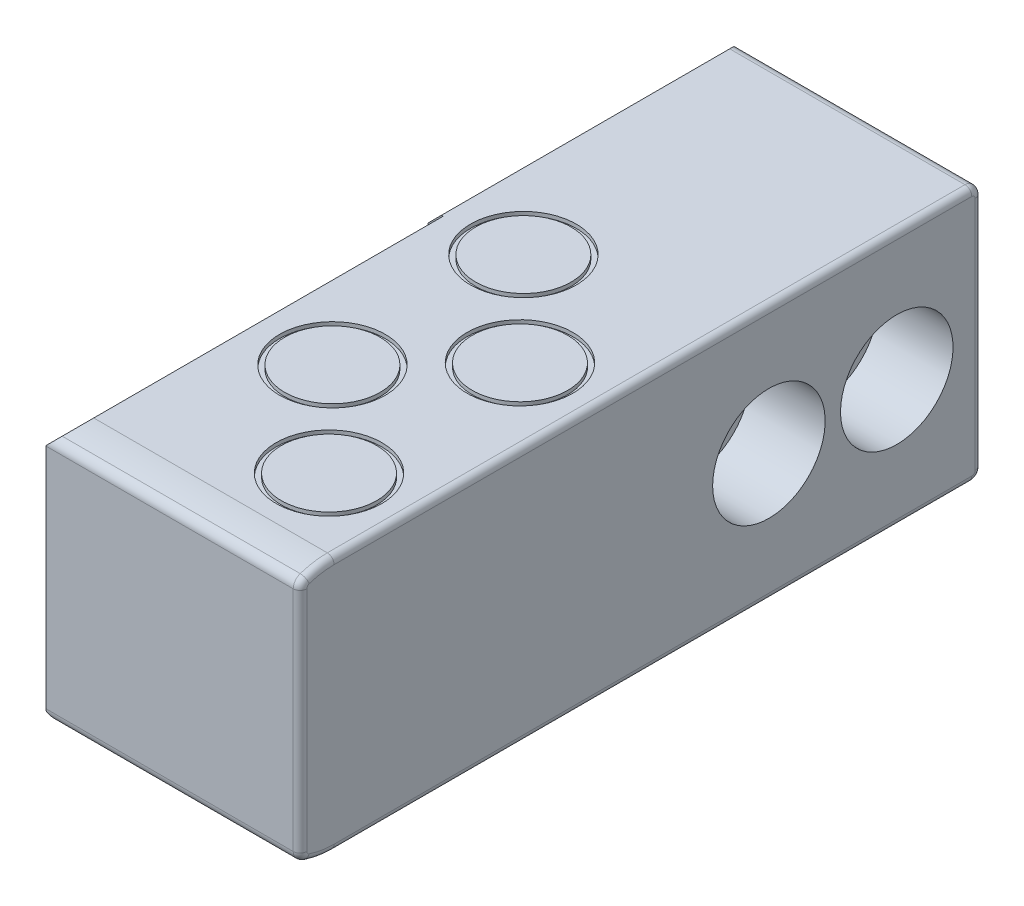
SolidWorks part; units mm, degrees
ref_plane "Front Plane" through (0, 0, 0) normal (0, 0, 1) x (1, 0, 0)
ref_plane "Top Plane" through (0, 0, 0) normal (0, 1, 0) x (1, 0, 0)
ref_plane "Right Plane" through (0, 0, 0) normal (1, 0, 0) x (0, 0, -1)
sketch "Sketch1" plane through (0, 0, 0) normal (1, 0, 0) x (0, 0, -1)
  line L0 (0, 0) -> (-28.575, 0) construction
  line L1 (-26.035, -9.525) -> (21.463, -9.525)
  line L2 (-28.575, -8.4726) -> (-28.575, 8.4726)
  line L3 (-26.035, 9.525) -> (21.463, 9.525)
  line L4 (22.225, -8.763) -> (22.225, 8.763)
  line L5 (0, 0) -> (22.225, 0) construction
  arc A0 (21.463, -9.525) -> (22.225, -8.763) centre (21.463, -8.763) ccw
  arc A1 (21.463, 9.525) -> (22.225, 8.763) centre (21.463, 8.763) cw
  arc A2 (-26.035, 9.525) -> (-28.0555, 9.195) centre (-26.035, 3.175) ccw
  arc A3 (-26.035, -9.525) -> (-28.0555, -9.195) centre (-26.035, -3.175) cw
  arc A4 (-28.575, -8.4726) -> (-28.0555, -9.195) centre (-27.813, -8.4726) ccw
  arc A5 (-28.0555, 9.195) -> (-28.575, 8.4726) centre (-27.813, 8.4726) ccw
  circle A6 centre (15.875, 0) radius 2.794
  circle A7 centre (6.35, 0) radius 2.794
  point P17 (-28.575, -8.9949)
  point P20 (-28.575, 8.9949)
  dimension "D5" = 0.762
  dimension "D9" = 6.35
  dimension "D4" = 0.762
  dimension "D7" = 5.588
  dimension "D10" = 5.588
  dimension "D2" = 50.8
  dimension "D3" = 22.225
  dimension "D6" = 2.54
  dimension "D8" = 6.35
  dimension "D11" = 9.525
  dimension "D12" = 19.05
  dimension "D13" = 0.33
extrude "Boss-Extrude1" add sketch "Sketch1" against normal blind 19.05
sketch "Sketch2" plane through (0, 9.525, 0) normal (0, 1, 0) x (1, 0, 0)
  line L0 (-19.05, 21.463) -> (-19.05, -26.035) construction
  line L1 (0, 21.463) -> (0, -26.035) construction
  line L5 (-19.05, -26.035) -> (0, -26.035) construction
  circle A2 centre (-12.446, -13.716) radius 3.937
  circle A3 centre (-12.446, -13.716) radius 3.556
  circle A4 centre (-5.588, -20.828) radius 3.556
  circle A5 centre (-5.588, -20.828) radius 3.937
  dimension "D1" = 1.27
  dimension "D2" = 5.588
  dimension "D5" = 7.874
  dimension "D7" = 6.604
  dimension "D8" = 7.112
  dimension "D3" = 7.112
  dimension "D4" = 6.858
  dimension "D9" = 12.446
extrude "Cut-Extrude1" cut sketch "Sketch2" against normal blind 0.2794
pattern_linear "LPattern2" count 2 spacing 14.224 along (0, 0, -1) of "Cut-Extrude1"
sketch "Sketch6" plane through (0, -9.525, 0) normal (0, -1, 0) x (1, 0, 0)
  line L0 (0, 61.1937) -> (0, -11.59) construction
  line L1 (-30.7169, 0) -> (6.3643, 0) construction
  circle A0 centre (-4.572, 45.72) radius 3.556
  circle A1 centre (-4.572, 45.72) radius 3.175
  circle A2 centre (-13.716, 45.72) radius 3.556
  circle A3 centre (-13.716, 45.72) radius 3.175
  circle A4 centre (-9.144, 39.116) radius 3.556
  circle A5 centre (-9.144, 39.116) radius 3.175
  dimension "D1" = 0.381
  dimension "D2" = 6.35
  dimension "D8" = 1.016
  dimension "D3" = 4.572
  dimension "D4" = 9.144
  dimension "D5" = 4.572
  dimension "D6" = 45.72
  dimension "D7" = 6.604
extrude "Cut-Extrude3" [suppressed] cut sketch "Sketch6" against normal blind 0.2794
pattern_linear "LPattern4" [suppressed] count 2 spacing 13.208
mirror "Mirror1" about plane through (0, 0, 0) normal (0, 1, 0) of "LPattern2", "Cut-Extrude1"
fillet "Fillet3" radius 0.508 12 edges at (0, 0, 28.575) (0, 8.9175, 28.4316) (0, 9.442, 27.0586) (0, 9.525, 2.286) (0, 9.3018, -22.0018) (0, 0, -22.225) (0, -9.3018, -22.0018) (0, -9.525, 2.286) (0, -9.442, 27.0586) (0, -8.9175, 28.4316) (0, 0, -18.669) (0, 0, -9.144)
ref_plane "Plane1" through (0, 0, -44.45) normal (0, 0, 1) x (1, 0, 0)
ref_plane "Plane2" through (0, 0, -15.875) normal (0, 0, 1) x (1, 0, 0)
sketch "Sketch4" plane through (0, 0, 0) normal (0, 1, 0) x (1, 0, 0)
  line L0 (-19.05, 15.875) -> (-0.508, 15.875) construction
  line L2 (-5.588, 15.875) -> (0, 15.875)
  line L4 (-5.588, 15.875) -> (-5.588, 20.066)
  line L5 (-5.588, 20.066) -> (0, 20.066)
  line L8 (0, 15.875) -> (0, 20.066)
  line L9 (0, 21.463) -> (0, -26.035) construction
  dimension "D1" = 4.191
  dimension "D2" = 5.588
revolve "Cut-Revolve1" cut sketch "Sketch4" angle 360 about axis through (-19.05, 0, -15.875) along (1, 0, 0)
pattern_linear "LPattern3" count 2 spacing 9.525 along (0, 0, 1) of "Cut-Revolve1"
sketch "Sketch5" plane through (-19.05, 0, 0) normal (-1, 0, 0) x (0, 0, 1)
  line L1 (0, -19.05) -> (127, -19.05)
  line L2 (0, -19.05) -> (0, 19.05)
  line L3 (0, 19.05) -> (127, 19.05)
  line L4 (127, -19.05) -> (127, 19.05)
  line L5 (10.4775, 0) -> (-10.4775, 0) construction
  dimension "D1" = 19.05
  dimension "D2" = 19.05
  dimension "D3" = 127
extrude "Cut-Extrude2" cut sketch "Sketch5" against normal blind 0.127
chamfer "Chamfer1" distance 1.016 angle 45 1 edges at (-18.923, 9.525, 13.0175)
chamfer "Chamfer2" distance 1.016 angle 45 3 edges at (-19.05, -9.525, -10.7315) (-19.05, 0, -22.225) (-19.05, 9.525, -10.7315)
